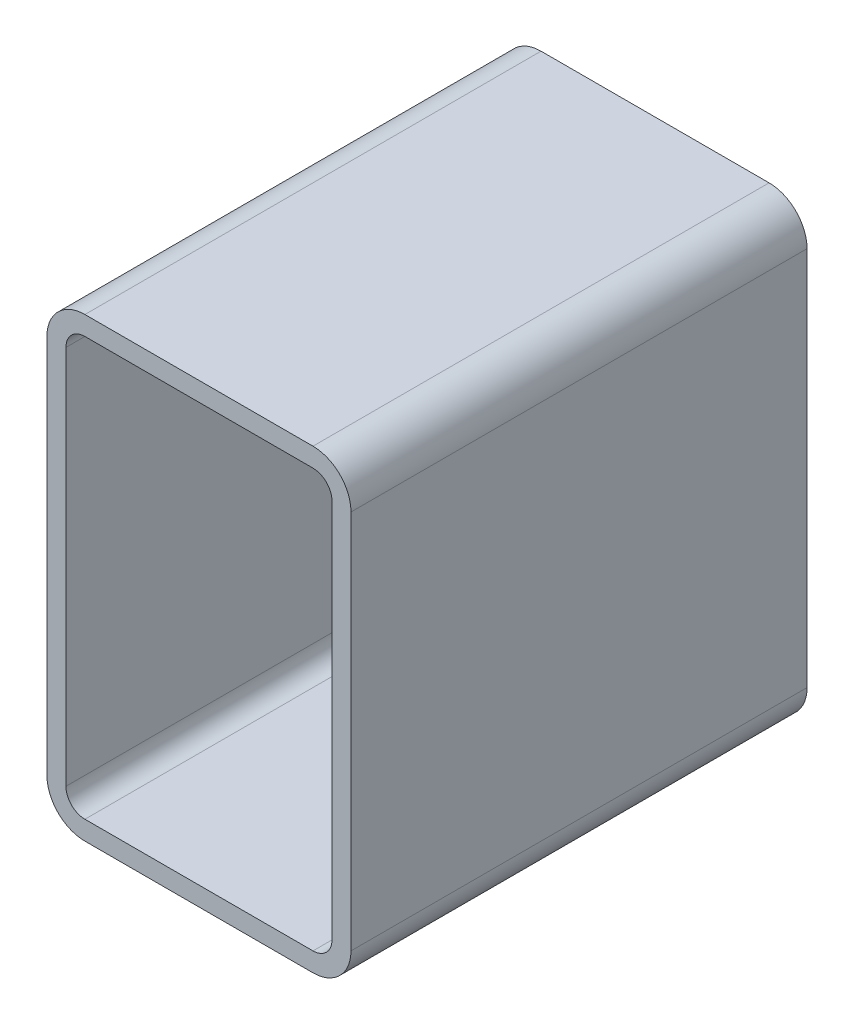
SolidWorks part; units mm, degrees
ref_plane "Front Plane" through (0, 0, 0) normal (0, 0, 1) x (1, 0, 0)
ref_plane "Top Plane" through (0, 0, 0) normal (0, 1, 0) x (1, 0, 0)
ref_plane "Right Plane" through (0, 0, 0) normal (1, 0, 0) x (0, 0, -1)
sketch "Sketch1" plane through (0, 0, 0) normal (0, 0, 1) x (1, 0, 0)
sketch_block_instance "HSS12x8x0.500-1"
sketch_block "HSS12x8x0.500"
extrude "Boss-Extrude1" add sketch "Sketch1" along normal blind 304.8
